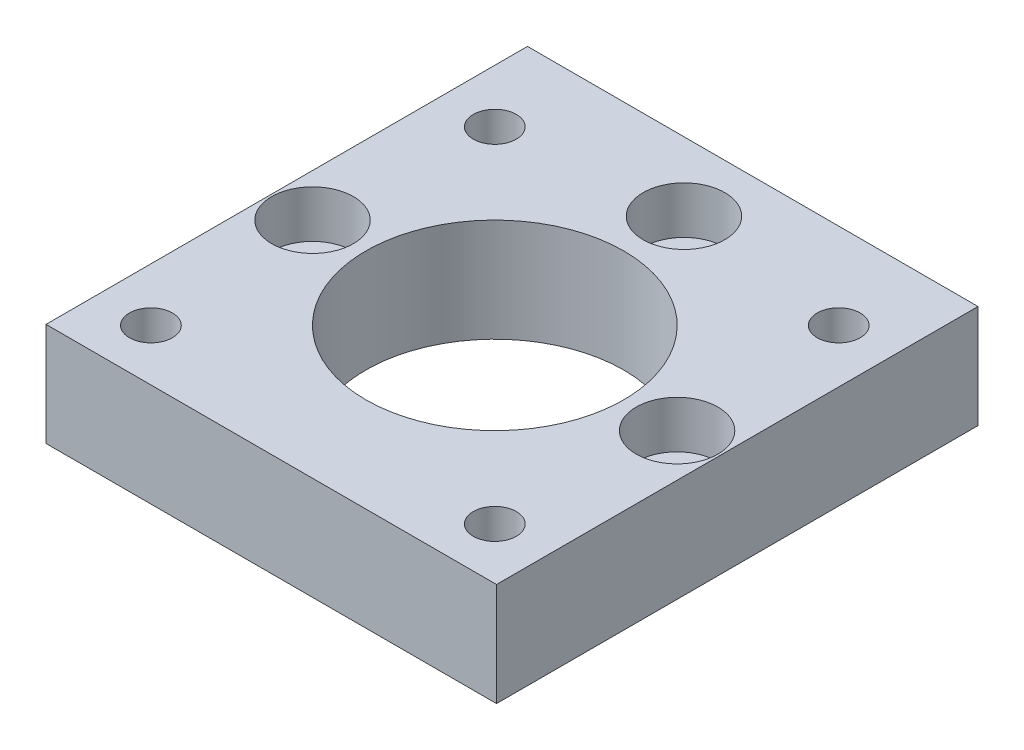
SolidWorks part; units mm, degrees
ref_plane "前视基准面" through (0, 0, 0) normal (0, 0, 1) x (1, 0, 0)
ref_plane "上视基准面" through (0, 0, 0) normal (0, 1, 0) x (1, 0, 0)
ref_plane "右视基准面" through (0, 0, 0) normal (1, 0, 0) x (0, 0, -1)
sketch "草图1" plane through (0, 0, 0) normal (0, 0, 1) x (1, 0, 0)
  line L0 (0, 0) -> (52.4, 0)
  line L1 (0, 12) -> (52.4, 12)
  line L2 (0, 0) -> (0, 12)
  line L3 (52.4, 0) -> (52.4, 12)
extrude "凸台-拉伸1" add sketch "草图1" along normal blind 56
sketch "草图2" plane through (0, 12, 0) normal (0, 1, 0) x (1, 0, 0)
  line L0 (0, 0) -> (52.4, 0)
  line L1 (0, -56) -> (52.4, -56)
  line L2 (0, -56) -> (0, 0)
  line L3 (52.4, -56) -> (52.4, 0)
  circle A0 centre (26.2, -30) radius 15
  circle A1 centre (6.2, -10) radius 2.5
  circle A2 centre (46.2, -10) radius 2.5
  circle A3 centre (46.2, -50) radius 2.5
  circle A4 centre (6.2, -50) radius 2.5
  circle A5 centre (47.4, -30) radius 2.75
  circle A6 centre (5, -30) radius 2.75
  circle A7 centre (26.2, -8) radius 2.75
extrude "切除-拉伸1" cut sketch "草图2" against normal blind 56 flip side to cut
sketch "草图3" plane through (0, 12, 0) normal (0, 1, 0) x (1, 0, 0)
  circle A0 centre (47.4, -30) radius 4.75
  circle A1 centre (5, -30) radius 4.75
  circle A2 centre (26.2, -8) radius 4.75
extrude "切除-拉伸2" cut sketch "草图3" against normal blind 5.5
